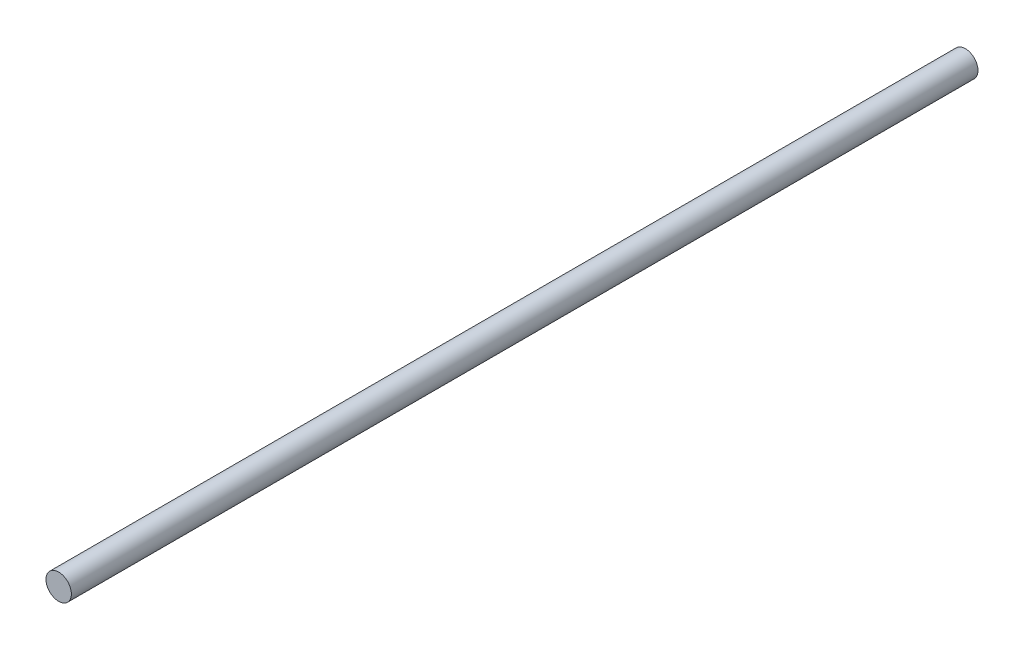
SolidWorks part; units mm, degrees
ref_plane "Ebene vorne" through (0, 0, 0) normal (0, 0, 1) x (1, 0, 0)
ref_plane "Ebene oben" through (0, 0, 0) normal (0, 1, 0) x (1, 0, 0)
ref_plane "Ebene rechts" through (0, 0, 0) normal (1, 0, 0) x (0, 0, -1)
sketch "Skizze1" plane through (0, 0, 0) normal (0, 0, 1) x (1, 0, 0)
  line L0 (-3.2, 1.4) -> (3.2, 1.4) construction
  circle A0 centre (0, 0) radius 1.4
extrude "Aufsatz-Linear austragen1" add sketch "Skizze1" along normal mid plane 100
